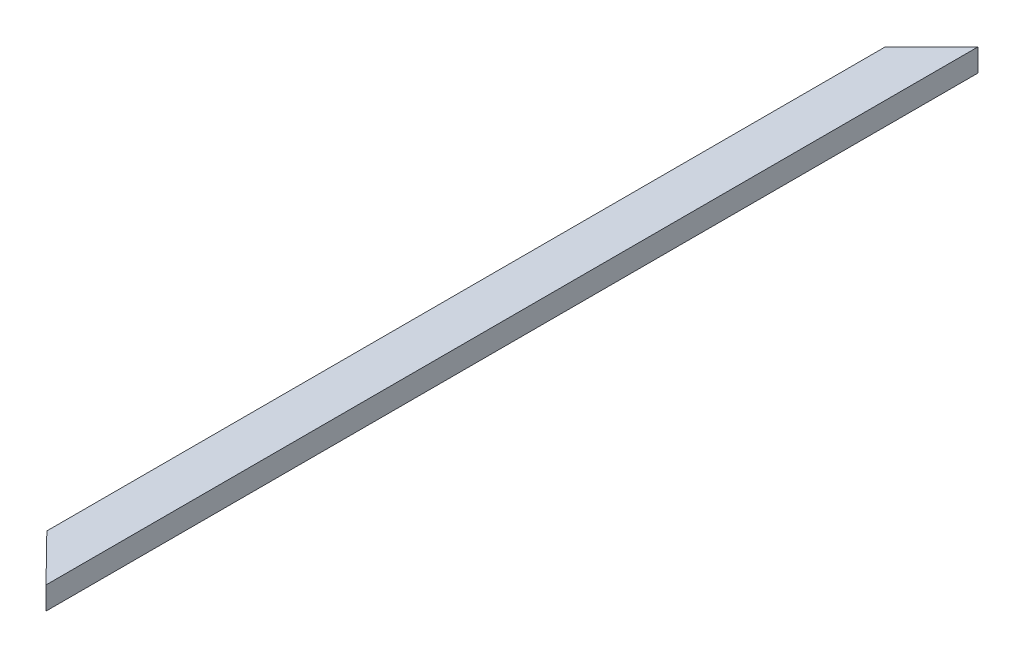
SolidWorks part; units mm, degrees
ref_plane "Plan de face" through (0, 0, 0) normal (0, 0, 1) x (1, 0, 0)
ref_plane "Plan de dessus" through (0, 0, 0) normal (0, 1, 0) x (1, 0, 0)
ref_plane "Plan de droite" through (0, 0, 0) normal (1, 0, 0) x (0, 0, -1)
sketch "Esquisse1" plane through (0, 0, 0) normal (0, 0, 1) x (1, 0, 0)
  line L1 (-23.5, 11.5) -> (23.5, 11.5)
  line L2 (-23.5, 11.5) -> (-23.5, -11.5)
  line L3 (-23.5, -11.5) -> (23.5, -11.5)
  line L4 (23.5, 11.5) -> (23.5, -11.5)
  line L5 (-23.5, 11.5) -> (23.5, -11.5) construction
  line L6 (-23.5, -11.5) -> (23.5, 11.5) construction
  point P0 (0, 0)
  dimension "D1" = 47
  dimension "D2" = 23
extrude "Boss.-Extru.1" add sketch "Esquisse1" along normal blind 850
sketch "Esquisse2" plane through (0, 0, 0) normal (0, 1, 0) x (1, 0, 0)
  line L0 (-23.5, -850) -> (23.5, -850) construction
  line L1 (-23.5, -850) -> (23.5, -897.8377)
  line L2 (23.5, -897.8377) -> (23.5, -850)
  line L3 (23.5, -850) -> (-23.5, -850)
  line L4 (-23.5, 0) -> (23.5, 0) construction
  line L5 (-23.5, 0) -> (23.5, 47)
  line L6 (23.5, 47) -> (23.5, 0)
  line L7 (23.5, 0) -> (-23.5, 0)
  arc A0 (13.764, -850) -> (2.8496, -876.3496) centre (-23.5, -850) cw
  arc A1 (12.0878, 0) -> (1.6644, 25.1644) centre (-23.5, 0) ccw
  point P0 (-23.5, -850)
extrude "Boss.-Extru.2" add sketch "Esquisse2" along normal mid plane 23 contours L6 L7 L5 | L2 L3 L1
